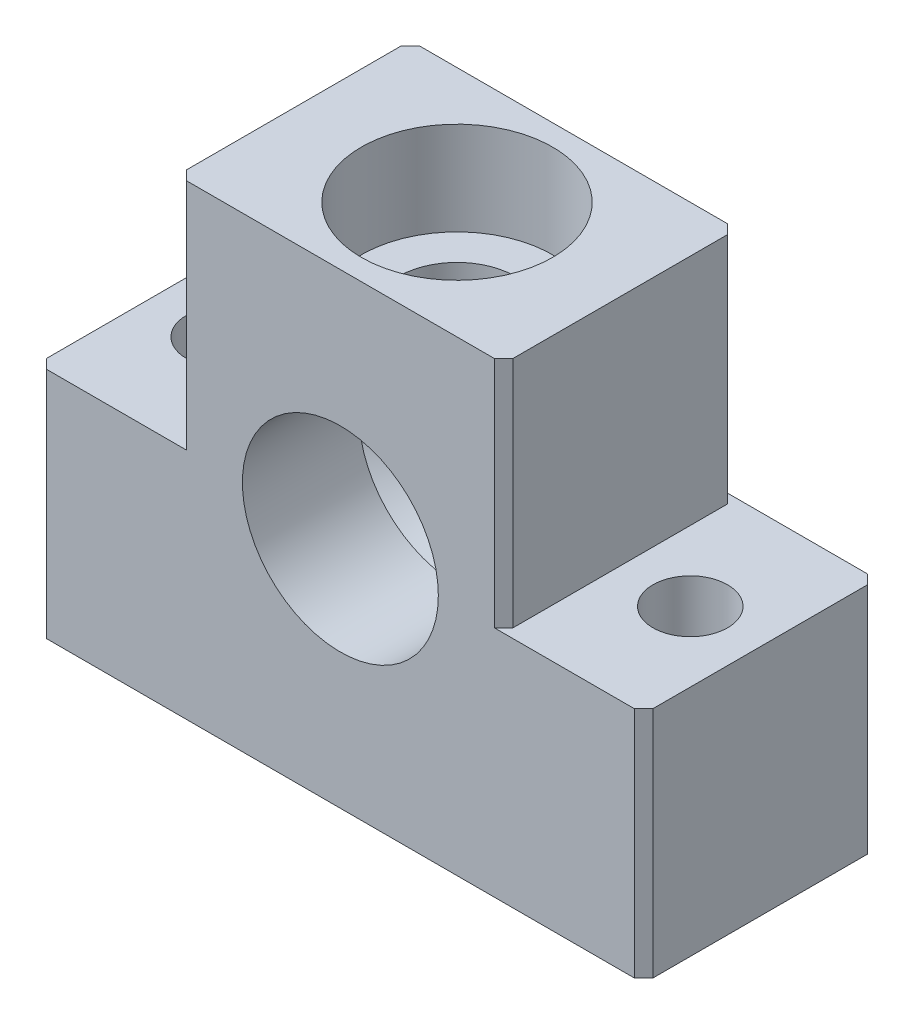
SolidWorks part; units mm, degrees
ref_plane "Front Plane" through (0, 0, 0) normal (0, 0, 1) x (1, 0, 0)
ref_plane "Top Plane" through (0, 0, 0) normal (0, 1, 0) x (1, 0, 0)
ref_plane "Right Plane" through (0, 0, 0) normal (1, 0, 0) x (0, 0, -1)
sketch "Sketch1" plane through (0, 0, 0) normal (0, 1, 0) x (1, 0, 0)
  line L1 (6.5, 2.5) -> (-6.5, 2.5)
  line L2 (6.5, 2.5) -> (6.5, -2.5)
  line L3 (6.5, -2.5) -> (-6.5, -2.5)
  line L4 (-6.5, 2.5) -> (-6.5, -2.5)
  line L5 (6.5, 2.5) -> (-6.5, -2.5) construction
  line L6 (6.5, -2.5) -> (-6.5, 2.5) construction
  point P0 (0, 0)
  dimension "D1" = 13
  dimension "D2" = 5
extrude "Boss-Extrude1" add sketch "Sketch1" along normal blind 10
hole_wizard "Ø2.5 (2.5) Diameter Hole1" positions "Sketch6" profile "Sketch5" hole size "Ø2.5" standard "ISO"
sketch "Sketch6" plane through (0, 10, 0) normal (0, 1, 0) x (1, 0, 0)
  point P0 (0, 0)
sketch "Sketch5" plane through (0, 10, 0) normal (1, 0, 0) x (0, 0, 1)
  line L0 (0, 0) -> (0, 6.25)
  line L1 (0, 6.25) -> (1.25, 5)
  line L2 (1.25, 5) -> (1.25, 0)
  line L5 (1.25, 0) -> (0, 0)
  line L10 (0, 6.25) -> (-1.25, 5) construction
  line L11 (0, -6.35) -> (0, 107.95) construction
  dimension "Hole Dia." = 2.5
  dimension "Hole Depth" = 5
  dimension "Drill Angle" = 90
hole_wizard "Ø4.1 (4.1) Diameter Hole1" positions "Sketch9" profile "Sketch10" hole size "Ø4.1" standard "ISO"
sketch "Sketch9" plane through (0, 10, 0) normal (0, 1, 0) x (1, 0, 0)
  point P0 (0, 0)
sketch "Sketch10" plane through (0, 10, 0) normal (1, 0, 0) x (0, 0, 1)
  line L0 (0, 0) -> (0, 2)
  line L1 (0, 2) -> (2.05, 2)
  line L2 (2.05, 2) -> (2.05, 0)
  line L5 (2.05, 0) -> (0, 0)
  line L10 (0, 2) -> (-2.05, 2) construction
  line L11 (0, -6.35) -> (0, 107.95) construction
  dimension "Hole Dia." = 4.1
  dimension "Hole Depth" = 2
  dimension "Drill Angle" = 180
hole_wizard "Ø4.2 (4.2) Diameter Hole1" positions "Sketch17" profile "Sketch16" hole size "Ø4.2" standard "ISO"
sketch "Sketch17" plane through (0, 0, 2.5) normal (0, 0, 1) x (1, 0, 0)
  line L0 (1.25, 5) -> (-1.25, 5) construction
  point P0 (0, 5)
sketch "Sketch16" plane through (0, 5, 2.5) normal (1, 0, 0) x (0, -1, 0)
  line L0 (0, 0) -> (0, 3.7618)
  line L1 (0, 3.7618) -> (2.1, 2.5)
  line L2 (2.1, 2.5) -> (2.1, 0)
  line L5 (2.1, 0) -> (0, 0)
  line L10 (0, 3.7618) -> (-2.1, 2.5) construction
  line L11 (0, -6.35) -> (0, 107.95) construction
  dimension "Hole Dia." = 4.2
  dimension "Hole Depth" = 2.5
  dimension "Drill Angle" = 118
sketch "Sketch18" plane through (0, 10, 0) normal (0, 1, 0) x (1, 0, 0)
  line L0 (-6.5, -2.5) -> (6.5, -2.5) construction
  line L1 (-6.5, 2.5) -> (-3.5, 2.5)
  line L2 (-6.5, 2.5) -> (-6.5, -2.5)
  line L3 (-6.5, -2.5) -> (-3.5, -2.5)
  line L4 (-3.5, 2.5) -> (-3.5, -2.5)
  line L6 (6.5, 2.5) -> (3.5, 2.5)
  line L7 (6.5, 2.5) -> (6.5, -2.5)
  line L8 (6.5, -2.5) -> (3.5, -2.5)
  line L9 (3.5, 2.5) -> (3.5, -2.5)
  dimension "D1" = 3
  dimension "D2" = 3
extrude "Cut-Extrude1" cut sketch "Sketch18" against normal blind 5
hole_wizard "M2 Tapped Hole1" positions "Sketch20" profile "Sketch19" tap size "M2" standard "ISO"
sketch "Sketch20" plane through (0, 0, 0) normal (0, -1, 0) x (-1, 0, 0)
  point P0 (5, 0)
  point P2 (-5, 0)
  dimension "D1" = 5
  dimension "D2" = 5
sketch "Sketch19" plane through (-5, 0, 0) normal (1, 0, 0) x (0, 0, -1)
  line L0 (0, 0) -> (0, 10)
  line L1 (0, 10) -> (0.8, 10)
  line L2 (0.8, 10) -> (0.8, 0)
  line L5 (0.8, 0) -> (0, 0)
  line L11 (0, -6.35) -> (0, 107.95) construction
  dimension "Thru Tap Drill Dia." = 1.6
  dimension "Thru Tap Drill Depth" = 10
chamfer "Chamfer1" distance 0.2 angle 45 8 edges at (6.5, 2.5, -2.5) (6.5, 2.5, 2.5) (-6.5, 2.5, 2.5) (-6.5, 2.5, -2.5) (-3.5, 7.5, -2.5) (3.5, 7.5, -2.5) (3.5, 7.5, 2.5) (-3.5, 7.5, 2.5)
